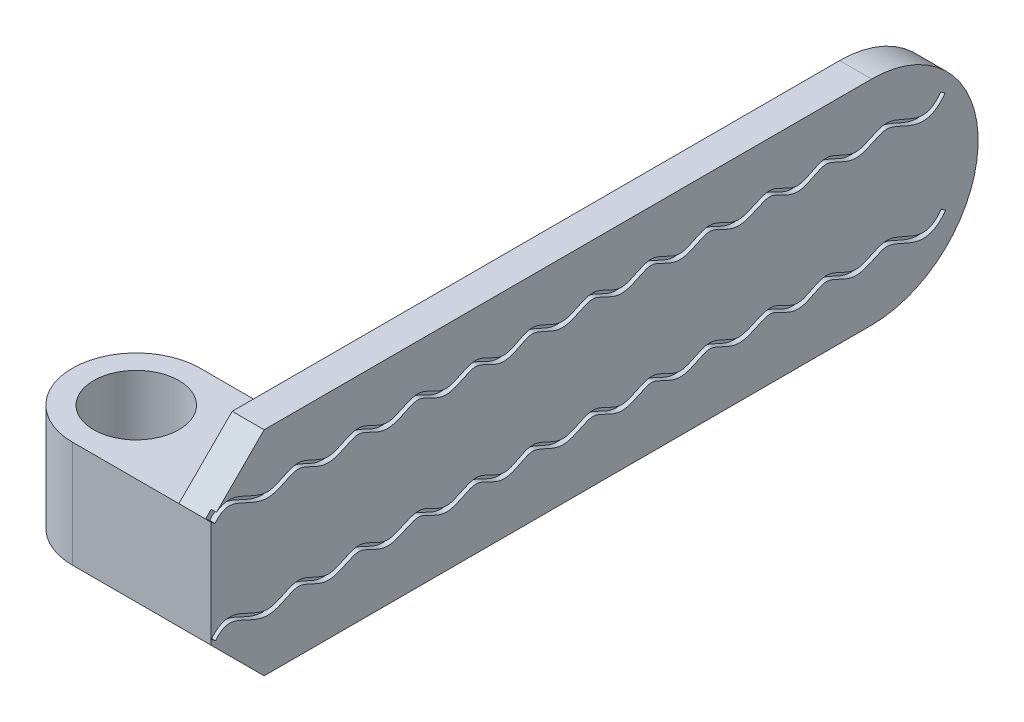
SolidWorks part; units mm, degrees
ref_plane "Front Plane" through (0, 0, 0) normal (0, 0, 1) x (1, 0, 0)
ref_plane "Top Plane" through (0, 0, 0) normal (0, 1, 0) x (1, 0, 0)
ref_plane "Right Plane" through (0, 0, 0) normal (1, 0, 0) x (0, 0, -1)
sketch "Sketch1" plane through (0, 0, 0) normal (0, 1, 0) x (1, 0, 0)
  line L0 (-26, 12) -> (-26, 24) construction
  line L1 (-26, 12) -> (-38, 12) construction
  line L2 (0, 0) -> (0, 144)
  line L3 (0, 144) -> (-6, 144)
  line L4 (-6, 24) -> (-6, 144)
  line L5 (-6, 24) -> (-26, 24)
  line L7 (0, 0) -> (-26, 0)
  arc A0 (-26, 24) -> (-26, 0) centre (-26, 12) ccw
  circle A1 centre (-26, 12) radius 8
  dimension "D5" = 16
  dimension "D1" = 6
  dimension "D2" = 120
  dimension "D3" = 24
  dimension "D4" = 20
extrude "Boss-Extrude1" add sketch "Sketch1" along normal blind 40
fillet "Fillet4" radius 10 1 edges at (-6, 20, -24)
sketch "Sketch15" plane through (0, 0, 0) normal (1, 0, 0) x (0, 0, -1)
  line L1 (0, 40) -> (144, 40) construction
  line L2 (0, 0) -> (144, 0) construction
  line L3 (144, 40) -> (144, 0) construction
  line L4 (124, 40) -> (124, 0)
  line L8 (0, 40) -> (0, 0)
  line L9 (0, 40) -> (0, 0)
  line L17 (0, 0) -> (144, 0)
  line L18 (144, 0) -> (144, 40)
  line L19 (144, 40) -> (0, 40)
  line L25 (124, 0) -> (144, 0)
  line L26 (144, 0) -> (144, 40)
  line L27 (144, 40) -> (124, 40)
  arc A1 (124, 40) -> (124, 0) centre (124, 20) cw
  dimension "D1" = 0
extrude "Cut-Extrude11" cut sketch "Sketch15" against normal through all both and the other way through all contours A1 L26 M17 | A1 M16 M15
sketch "Sketch16" plane through (0, 0, 0) normal (0, -1, 0) x (1, 0, 0)
  line L0 (-6, -34) -> (-6, 0)
  line L5 (-6, -124) -> (0, -124)
  line L6 (0, -124) -> (0, 0)
  line L7 (0, 0) -> (-26, 0)
  line L8 (-26, -24) -> (-16, -24)
  line L9 (-6, -34) -> (-6, -124)
  line L12 (-6, 0) -> (-26, 0)
  line L13 (-26, -24) -> (-16, -24)
  arc A2 (-26, 0) -> (-26, -24) centre (-26, -12) ccw
  arc A3 (-6, -34) -> (-16, -24) centre (-16, -34) ccw
  arc A4 (-26, 0) -> (-26, -24) centre (-26, -12) ccw
  arc A5 (-6, -34) -> (-16, -24) centre (-16, -34) ccw
  dimension "D1" = 0
extrude "Cut-Extrude12" cut sketch "Sketch16" against normal blind 10
sketch "Sketch19" plane through (0, 10, 0) normal (0, -1, 0) x (1, 0, 0)
  line L3 (-6, -34) -> (-6, 0)
  line L4 (-6, 0) -> (-26, 0)
  line L5 (-26, -24) -> (-16, -24)
  line L6 (-6, -34) -> (-6, 0)
  line L7 (-6, 0) -> (-26, 0)
  line L8 (-26, -24) -> (-16, -24)
  arc A2 (-26, 0) -> (-26, -24) centre (-26, -12) ccw
  arc A3 (-6, -34) -> (-16, -24) centre (-16, -34) ccw
  arc A4 (-26, 0) -> (-26, -24) centre (-26, -12) ccw
  arc A5 (-6, -34) -> (-16, -24) centre (-16, -34) ccw
  dimension "D1" = 0
extrude "Cut-Extrude13" cut sketch "Sketch19" against normal blind 10 from offset 20
chamfer "Chamfer1" distance 10 angle 45 2 edges at (-3, 0, 0) (-3, 40, 0)
sketch "Sketch20" plane through (0, 0, 0) normal (1, 0, 0) x (0, 0, -1)
  line L0 (0.7769, 29.3704) -> (0, 30)
  line L1 (136.974, 31.4141) -> (137.7884, 30.8338)
  line L14 (136.974, 11.6141) -> (137.7884, 11.0338)
  line L15 (0.7769, 9.5704) -> (0, 10.2)
  line L16 (136.974, 28.1141) -> (137.7884, 27.5338)
  line L17 (0.7769, 26.0704) -> (0, 26.7)
  line L18 (136.974, 24.8141) -> (137.7884, 24.2338)
  line L19 (0.7769, 22.7704) -> (0, 23.4)
  line L20 (136.974, 21.5141) -> (137.7884, 20.9338)
  line L21 (0.7769, 19.4704) -> (0, 20.1)
  line L22 (136.974, 14.9141) -> (137.7884, 14.3338)
  line L23 (0.7769, 12.8704) -> (0, 13.5)
  line L24 (136.974, 18.2141) -> (137.7884, 17.6338)
  line L25 (0.7769, 16.1704) -> (0, 16.8)
  line L26 (10, 40) -> (0, 30) construction
  spline S0 degree 3 poles (0, 30) (3.7637, 34.6446) (9.1661, 26.57) (16.4494, 33.101) (22.0259, 27.8272) (27.6112, 33.1682) (33.2066, 27.7937) (38.7739, 33.2168) (44.2174, 27.8659) (49.6337, 33.2485) (54.9688, 27.928) (60.3222, 33.2158) (65.9493, 27.7569) (71.5942, 33.1805) (77.0975, 27.852) (82.5817, 33.2066) (88.0422, 27.8701) (93.5108, 33.1847) (99.1587, 27.75) (104.7816, 33.2312) (110.1025, 27.9492) (115.4148, 33.2156) (120.9202, 27.9016) (128.1122, 34.4236) (133.5168, 26.562) (136.974, 31.4141) knots 0 0 0 0 0.079611 0.11899 0.159936 0.201599 0.240265 0.284224 0.320626 0.362644 0.400958 0.438526 0.4813 0.522826 0.561628 0.602909 0.641955 0.682147 0.722278 0.766455 0.802643 0.841506 0.882971 0.92243 1 1 1 1
  spline S1 degree 1 poles (0.7769, 29.3704) (137.7884, 30.8338) knots 0 0 1 1 construction
  spline S2 degree 3 number of poles 144 (0.7769, 29.3704) -> (137.7884, 30.8338)
  point P0 (11, 29.6294)
  point P1 (22, 29.6294)
  point P2 (33, 29.6294)
  point P3 (44, 29.6294)
  point P4 (55, 29.6294)
  point P5 (66, 29.6294)
  point P6 (77, 29.6294)
  point P7 (88, 29.6294)
  point P8 (99, 29.6294)
  point P9 (110, 29.6294)
  point P10 (121, 29.6294)
  point P11 (132, 29.6294)
  point P12 (5.546, 31.4141)
  point P14 (16.3815, 31.4141)
  point P15 (27.7269, 31.4141)
  point P16 (39.0723, 31.4141)
  point P17 (49.7803, 31.4141)
  point P18 (60.1058, 31.4141)
  point P19 (71.7062, 31.4141)
  point P20 (82.6691, 31.4141)
  point P21 (93.5046, 31.4141)
  point P22 (105.105, 31.4141)
  point P23 (115.3031, 31.4141)
  point P24 (126.3935, 31.4141)
  point P25 (136.974, 31.4141)
  dimension "D1" = 11
  dimension "D2" = 11
  dimension "D3" = 11
  dimension "D4" = 11
  dimension "D5" = 11
  dimension "D6" = 11
  dimension "D7" = 11
  dimension "D8" = 11
  dimension "D9" = 11
  dimension "D10" = 11
  dimension "D11" = 11
  dimension "D12" = 11
  dimension "D13" = 1
  dimension "D14" = 7
extrude "Cut-Extrude14" cut sketch "Sketch20" against normal blind 1
sketch "Sketch21" plane through (0, 0, 0) normal (1, 0, 0) x (0, 0, -1)
  line L0 (0.0882, 10.8988) -> (0.8651, 10.2692)
  line L1 (137.8766, 11.7326) -> (137.0622, 12.3129)
  spline S0 degree 3 poles (137.0622, 12.3129) (133.6049, 7.4608) (128.2003, 15.3224) (121.0083, 8.8004) (115.5029, 14.1144) (110.1907, 8.848) (104.8697, 14.13) (99.2469, 8.6488) (93.599, 14.0835) (88.1304, 8.7689) (82.6698, 14.1054) (77.1856, 8.7508) (71.6823, 14.0793) (66.0375, 8.6557) (60.4104, 14.1146) (55.0569, 8.8268) (49.7218, 14.1473) (44.3055, 8.7647) (38.8621, 14.1156) (33.2947, 8.6925) (27.6994, 14.067) (22.114, 8.726) (16.5376, 13.9998) (9.2543, 7.4688) (3.8519, 15.5434) (0.0882, 10.8988) knots 0 0 0 0 0.07757 0.117029 0.158494 0.197357 0.233545 0.277722 0.317853 0.358045 0.397091 0.438372 0.477174 0.5187 0.561474 0.599042 0.637356 0.679374 0.715776 0.759735 0.798401 0.840064 0.88101 0.920389 1 1 1 1
  spline S1 degree 3 number of poles 144 (0.8651, 10.2692) -> (137.8766, 11.7326)
  dimension "D2" = 2
extrude "Cut-Extrude18" cut sketch "Sketch21" against normal blind 1
